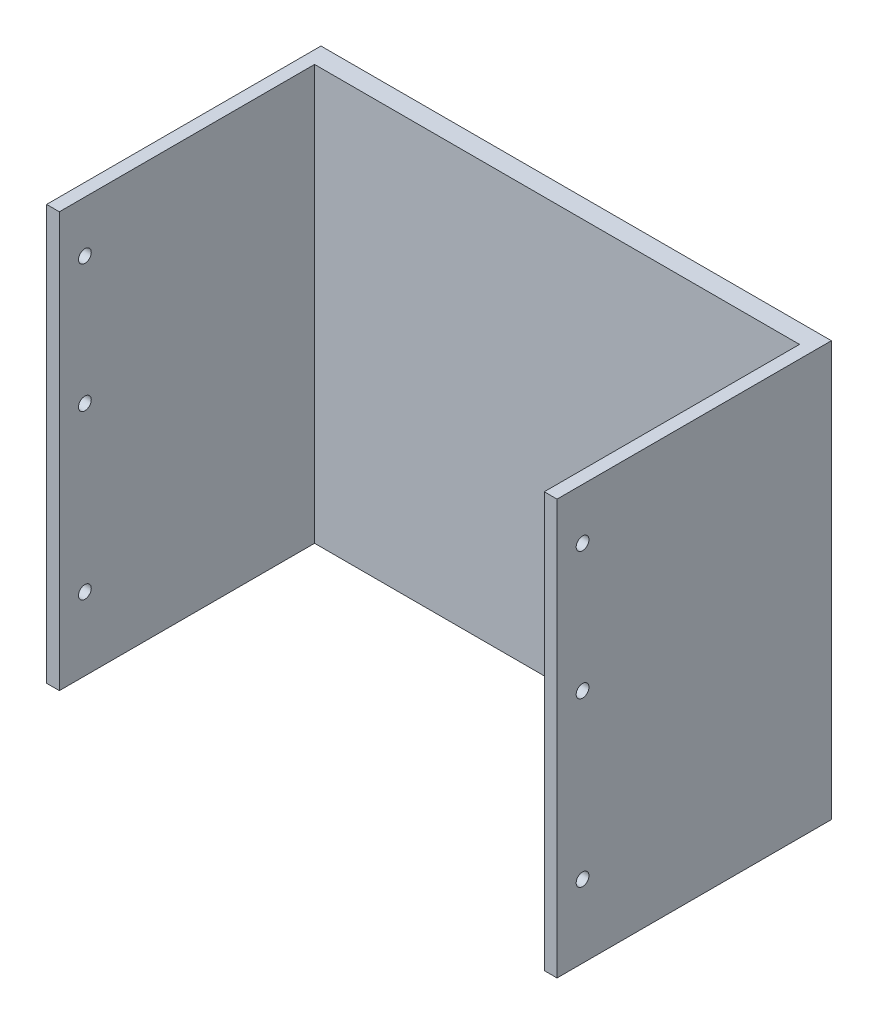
SolidWorks part; units mm, degrees
ref_plane "前视基准面" through (0, 0, 0) normal (0, 0, 1) x (1, 0, 0)
ref_plane "上视基准面" through (0, 0, 0) normal (0, 1, 0) x (1, 0, 0)
ref_plane "右视基准面" through (0, 0, 0) normal (1, 0, 0) x (0, 0, -1)
sketch "草图1" plane through (0, 0, 0) normal (0, 0, 1) x (1, 0, 0)
  line L1 (-40, 32.5) -> (40, 32.5)
  line L2 (-40, 32.5) -> (-40, -32.5)
  line L3 (-40, -32.5) -> (40, -32.5)
  line L4 (40, 32.5) -> (40, -32.5)
  line L5 (-40, 32.5) -> (40, -32.5) construction
  line L6 (-40, -32.5) -> (40, 32.5) construction
  point P0 (0, 0)
  dimension "D1" = 65
  dimension "D2" = 80
extrude "凸台-拉伸1" add sketch "草图1" along normal blind 3
sketch "草图2" plane through (0, 0, 3) normal (0, 0, 1) x (1, 0, 0)
  line L0 (-40, -32.5) -> (40, -32.5) construction
  line L1 (-40, 32.5) -> (-38, 32.5)
  line L2 (-40, 32.5) -> (-40, -32.5)
  line L3 (-40, -32.5) -> (-38, -32.5)
  line L4 (-38, 32.5) -> (-38, -32.5)
  line L5 (0, -1.65) -> (0, 1.65) construction
  line L6 (40, -32.5) -> (38, -32.5)
  line L7 (38, 32.5) -> (38, -32.5)
  line L8 (40, 32.5) -> (38, 32.5)
  line L9 (40, 32.5) -> (40, -32.5)
  dimension "D1" = 2
extrude "凸台-拉伸2" add sketch "草图2" along normal blind 40
sketch "草图3" plane through (-40, 0, 0) normal (-1, 0, 0) x (0, 0, 1)
  line L0 (43, 32.5) -> (43, -32.5) construction
  line L1 (43, 32.5) -> (0, 32.5) construction
  circle A0 centre (39, 24.5) radius 1
  circle A1 centre (39, -21.0951) radius 1
  circle A2 centre (39, 4.4854) radius 1
  point P2 (0, 0)
  point P9 (39, -16.0105)
  point P12 (0, 0)
  point P13 (39, 4.4854)
  point P14 (39, -21.0951)
  dimension "D1" = 4
  dimension "D3" = 2
  dimension "D2" = 8
extrude "切除-拉伸1" cut sketch "草图3" against normal blind 10
mirror "镜向1" about plane through (0, 0, 0) normal (1, 0, 0) of "切除-拉伸1"
